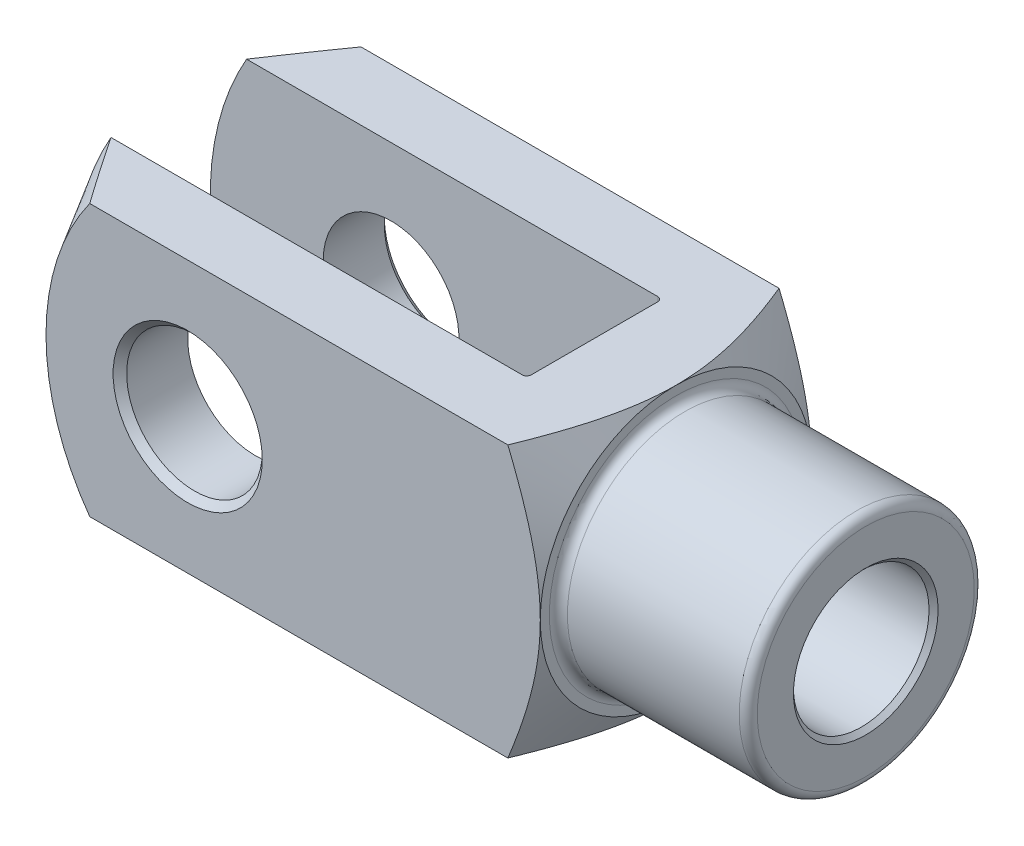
SolidWorks part; units mm, degrees
ref_plane "Front Plane" through (0, 0, 0) normal (0, 0, 1) x (1, 0, 0)
ref_plane "Top Plane" through (0, 0, 0) normal (0, 1, 0) x (1, 0, 0)
ref_plane "Right Plane" through (0, 0, 0) normal (1, 0, 0) x (0, 0, -1)
sketch "Sketch1" plane through (0, 0, 0) normal (1, 0, 0) x (0, 0, -1)
  line L0 (0, 0) -> (0, 50000) construction
  line L1 (0, 0) -> (50000, 0) construction
  line L2 (-30, -30) -> (-30, 30)
  line L3 (-30, 30) -> (30, 30)
  line L4 (30, -30) -> (30, 30)
  line L5 (-30, -30) -> (30, -30)
  point P9 (0, 30)
  point P11 (30, 0)
  point P12 (-30, 0)
  dimension "D1" = 60
  dimension "D2" = 60
extrude "Extrude1" add sketch "Sketch1" against normal blind 160
sketch "Sketch2" plane through (0, 0, 0) normal (1, 0, 0) x (0, 0, -1)
  circle A0 centre (0, 0) radius 26
  circle A1 centre (0, 0) radius 52
  dimension "D1" = 52
  dimension "D2" = 104
extrude "Extrude2" cut sketch "Sketch2" against normal blind 42
sketch "Sketch3" plane through (0, 0, 30) normal (0, 0, 1) x (1, 0, 0)
  circle A0 centre (-120, 0) radius 15
  dimension "D1" = 30
  dimension "D2" = 120
extrude "Extrude3" cut sketch "Sketch3" against normal through all
sketch "Sketch4" plane through (0, 30, 0) normal (0, 1, 0) x (1, 0, 0)
  line L0 (0, 0) -> (-50000, 0) construction
  line L1 (-160, -15) -> (-160, 15)
  line L2 (-160, 30) -> (-160, -30) construction
  line L3 (-160, 15) -> (-60, 15)
  line L4 (-60, 15) -> (-60, -15)
  line L5 (-120, 30) -> (-120, -30) construction
  line L6 (-160, -15) -> (-60, -15)
  point P7 (-120, 0)
  point P13 (-60, 0)
  point P14 (-160, 0)
  dimension "D1" = 60
  dimension "D2" = 30
extrude "Extrude4" cut sketch "Sketch4" against normal through all
fillet "Fillet1" radius 1 2 edges at (-60, 0, 15) (-60, 0, -15)
fillet "Fillet2" radius 2 2 edges at (0, 0, -26) (-42, 0, -26)
chamfer "Chamfer2" distance 1.5 angle 45 2 edges at (-105, 0, -30) (-105, 0, 30)
sketch "Sketch6" plane through (0, 0, 0) normal (0, 0, 1) x (1, 0, 0)
  line L0 (-42, -30) -> (-42, -60)
  line L1 (-42, -60) -> (-59.3205, -60)
  line L2 (-59.3205, -60) -> (-42, -30)
  dimension "D1" = 30
  dimension "D2" = 60
revolve "Cut-Revolve1" cut sketch "Sketch6" angle 360 about axis through (-42, 0, 0) along (1, 0, 0)
sketch "Sketch7" plane through (0, 0, 0) normal (0, 1, 0) x (1, 0, 0)
  line L0 (-151.3397, -30) -> (-160, -15)
  line L1 (-160, 15) -> (-151.3397, 30)
  line L2 (-151.3397, 30) -> (-220, 30)
  line L3 (-160, 15) -> (-160, -15)
  line L4 (-220, 30) -> (-220, -30)
  line L5 (-220, -30) -> (-151.3397, -30)
  line L6 (-160, 30) -> (-49.1744, 30) construction
  line L7 (-160, -30) -> (-49.1744, -30) construction
  line L8 (-100, 0.6162) -> (-100, 50000.6162) construction
  dimension "D1" = 120
  dimension "D2" = 60
  dimension "D3" = 60
revolve "Cut-Revolve2" cut sketch "Sketch7" angle 180 about L8
sketch "Sketch8" plane through (0, 0, 0) normal (1, 0, 0) x (0, 0, -1)
  circle A0 centre (0, 0) radius 15
  dimension "D1" = 30
extrude "Extrude5" cut sketch "Sketch8" against normal through all
chamfer "Chamfer3" distance 1 angle 45 1 edges at (0, 0, -15)
equation "\"D2@Sketch1\" = \"D1@Sketch1\""
equation "\"D2@Sketch2\" = \"D1@Sketch2\"*2"
equation "\"D2@Sketch6\" = \"D1@Sketch1\""
equation "\"D2@Sketch7\" = \"D1@Sketch1\""
equation "\"D3@Sketch7\" = \"D1@Sketch1\""
